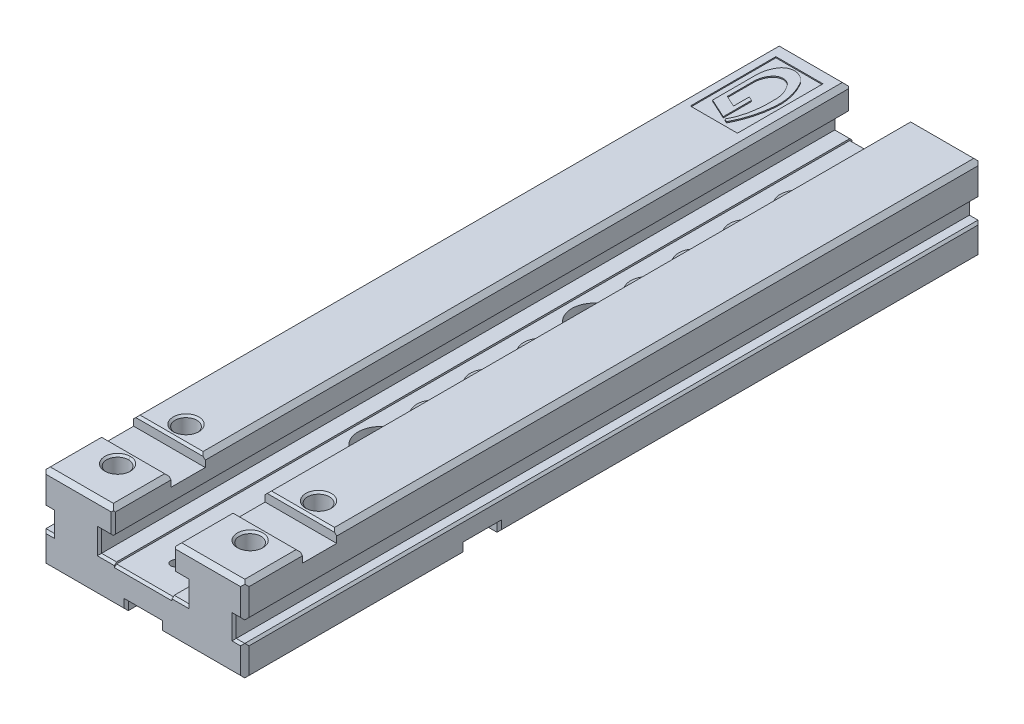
SolidWorks part; units mm, degrees
ref_plane "Front Plane" through (0, 0, 0) normal (0, 0, 1) x (1, 0, 0)
ref_plane "Top Plane" through (0, 0, 0) normal (0, 1, 0) x (1, 0, 0)
ref_plane "Right Plane" through (0, 0, 0) normal (1, 0, 0) x (0, 0, -1)
imported_body "Imported1"
sketch "Sketch1" plane through (0, 17.2, 0) normal (0, 1, 0) x (1, 0, 0)
  circle A0 centre (0, -234) radius 12.4968
  circle A1 centre (0, -134) radius 12.4968
extrude "Boss-Extrude1" add sketch "Sketch1" against normal up to surface (11.2 mm away)
hole_wizard "Hole1" positions "Sketch3" profile "Sketch2" legacy
sketch "Sketch3" plane through (0, 17.2, 0) normal (0, 1, 0) x (1, 0, 0)
  line L0 (-15, -345) -> (-45.5, -345) construction
  point P0 (0, -234)
  point P5 (0, -134)
  dimension "D1" = 111
  dimension "D2" = 100
sketch "Sketch2" plane through (0, 17.2, 234) normal (1, 0, 0) x (0, 0, 1)
  line L0 (0, 0) -> (0, 100)
  line L1 (0, 100) -> (8, 100)
  line L2 (8, 100) -> (8, 5.5)
  line L3 (8, 5.5) -> (10.5, 5.5)
  line L4 (10.5, 5.5) -> (10.5, 0)
  line L5 (10.5, 0) -> (0, 0)
  line L6 (0, 110) -> (0, -10) construction
  dimension "Diameter" = 16
  dimension "Depth" = 100
  dimension "C-Bore Diameter" = 21
  dimension "C-Bore Depth" = 5.5
